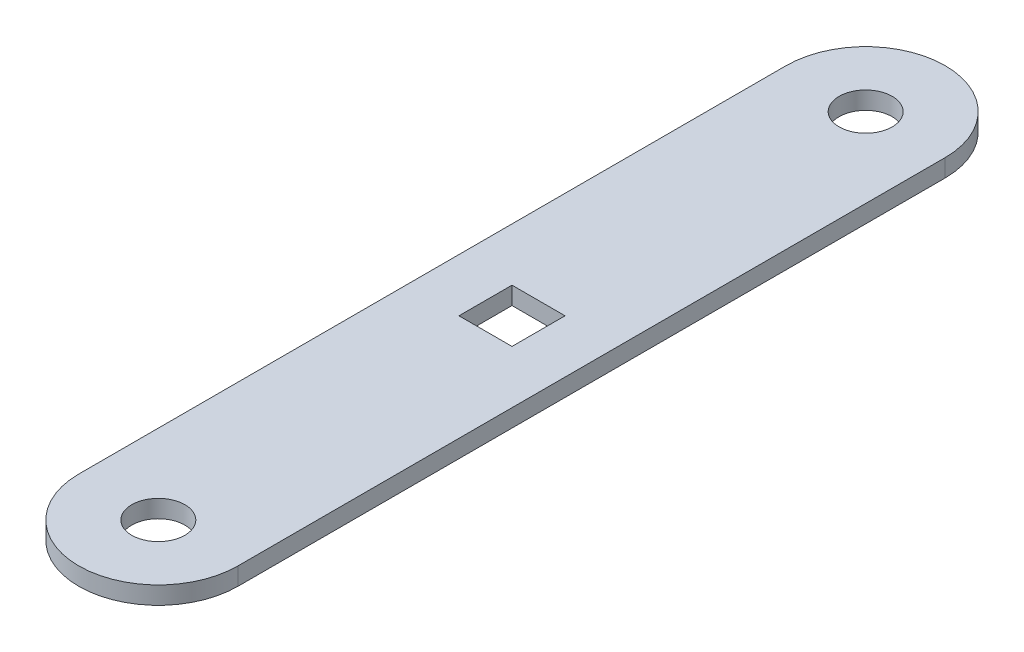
SolidWorks part; units mm, degrees
ref_plane "Front Plane" through (0, 0, 0) normal (0, 0, 1) x (1, 0, 0)
ref_plane "Top Plane" through (0, 0, 0) normal (0, 1, 0) x (1, 0, 0)
ref_plane "Right Plane" through (0, 0, 0) normal (1, 0, 0) x (0, 0, -1)
sketch "Sketch1" plane through (0, 0, 0) normal (0, 1, 0) x (1, 0, 0)
  line L1 (-225, -1000) -> (225, -1000)
  line L2 (-225, -1000) -> (-225, 1000)
  line L3 (-225, 1000) -> (225, 1000)
  line L4 (225, -1000) -> (225, 1000)
  line L5 (-225, -1000) -> (225, 1000) construction
  line L6 (-225, 1000) -> (225, -1000) construction
  arc A0 (225, -1000) -> (-225, -1000) centre (0, -1000) cw
  arc A1 (225, 1000) -> (-225, 1000) centre (0, 1000) ccw
  point P0 (0, 0)
  dimension "D1" = 2000
  dimension "D2" = 450
extrude "Boss-Extrude1" add sketch "Sketch1" along normal blind 50 contours L1 L4 L3 L2 | L3 A1 | A0 L1
sketch "Sketch2" plane through (0, 50, 0) normal (0, 1, 0) x (1, 0, 0)
  line L0 (-225, -1000) -> (225, -1000)
  line L1 (-225, -1000) -> (-225, 1000) construction
  circle A0 centre (0, -1000) radius 75
sketch "Sketch3" plane through (0, 50, 0) normal (0, 1, 0) x (1, 0, 0)
  line L0 (-225, 1000) -> (225, 1000)
  circle A0 centre (0, 1000) radius 75
extrude "Cut-Extrude2" cut sketch "Sketch3" against normal blind 250 contours L0 A0 | L0 A0
extrude "Cut-Extrude4" cut sketch "Sketch2" against normal through all contours L0 A0 | L0 A0
sketch "Sketch4" plane through (0, 50, 0) normal (0, 1, 0) x (1, 0, 0)
  line L1 (-75, -75) -> (75, -75)
  line L2 (-75, -75) -> (-75, 75)
  line L3 (-75, 75) -> (75, 75)
  line L4 (75, -75) -> (75, 75)
  line L5 (-75, -75) -> (75, 75) construction
  line L6 (-75, 75) -> (75, -75) construction
  point P0 (0, 0)
  dimension "D1" = 150
  dimension "D2" = 150
extrude "Cut-Extrude5" cut sketch "Sketch4" against normal through all
